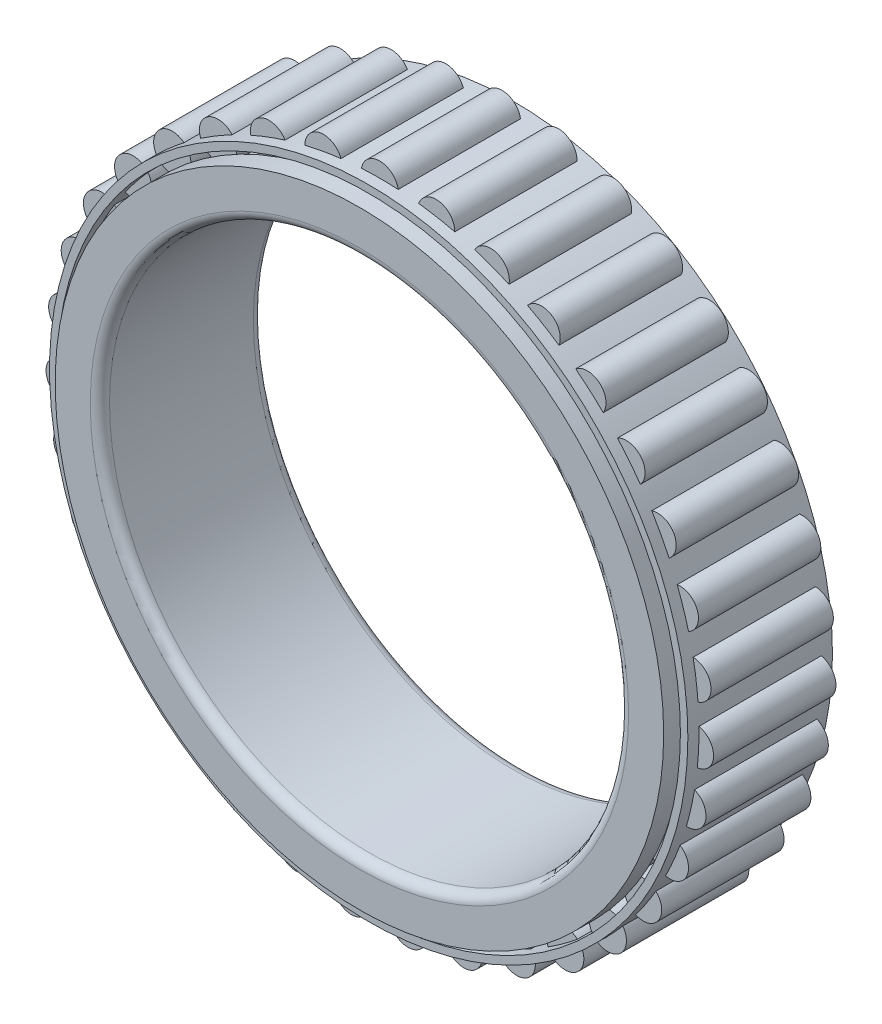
SolidWorks part; units mm, degrees
ref_plane "Front Plane" through (0, 0, 0) normal (0, 0, 1) x (1, 0, 0)
ref_plane "Top Plane" through (0, 0, 0) normal (0, 1, 0) x (1, 0, 0)
ref_plane "Right Plane" through (0, 0, 0) normal (1, 0, 0) x (0, 0, -1)
sketch "BaseSke" plane through (0, 0, 0) normal (1, 0, 0) x (0, 0, -1)
  line L0 (-42.3546, 0) -> (24.6132, 0) construction
  line L1 (-42.3546, 42.5375) -> (24.6132, 42.5375) construction
  line L2 (0, 129.5214) -> (0, -86.3012) construction
  line L3 (-8.25, 42.5375) -> (-8.25, 45.05) construction
  line L5 (-11, 35) -> (11, 35) construction
  line L6 (-8.25, 40.025) -> (8.25, 40.025)
  line L7 (-8.25, 40.025) -> (-8.25, 42.5375)
  line L8 (-8.25, 42.5375) -> (8.25, 42.5375)
  line L9 (8.25, 40.025) -> (8.25, 42.5375)
  line L10 (-8.25, 45.05) -> (8.25, 45.05) construction
  line L11 (8.25, 45.05) -> (8.25, 42.5375) construction
  line L12 (-8.25, 40.025) -> (-8.25, 35) construction
  line L13 (-8.25, 45.05) -> (-8.25, 40.025) construction
  dimension "D2" = 16.5
  dimension "Bearing_Thickness" = 22
  dimension "Bearing_Outside_Diameter" = 90.1
  dimension "Bearing_Inside_Diameter" = 70
revolve "Roller" add sketch "BaseSke" angle 360 about L8
sketch "OuterRaceSke" plane through (0, 0, 0) normal (1, 0, 0) x (0, 0, -1)
  line L0 (0, 0) -> (0, 87.5396) construction
  line L1 (-11, 35) -> (11, 35)
  line L2 (-11, 35) -> (-11, 41.03)
  line L3 (-11, 41.03) -> (-8.275, 41.03)
  line L4 (11, 35) -> (11, 41.03)
  line L5 (-50.3916, 0) -> (55.2197, 0) construction
  line L7 (8.275, 41.03) -> (11, 41.03)
  line L8 (-8.25, 40.025) -> (8.25, 40.025) construction
  line L9 (-8.275, 41.03) -> (-8.275, 40.045)
  line L10 (-8.275, 40.045) -> (8.275, 40.045)
  line L11 (8.275, 41.03) -> (8.275, 40.045)
  dimension "D1" = 16.55
  dimension "D2" = 82.06
  dimension "D3" = 0.02
revolve "OuterRace" add sketch "OuterRaceSke" angle 360 about L5
sketch "CageSke" plane through (0, 0, 0) normal (1, 0, 0) x (0, 0, -1)
  line L0 (-70.8626, 0) -> (113.5527, 0) construction
  line L1 (0, 58.441) -> (0, -70.8113) construction
  line L2 (-9.75, 42.035) -> (9.75, 42.035)
  line L3 (-9.75, 42.035) -> (-9.75, 43.04)
  line L4 (-33.2996, 42.5375) -> (13.017, 42.5375) construction
  line L5 (-42.3546, 42.5375) -> (24.6132, 42.5375) construction
  line L6 (0, 129.5214) -> (0, -86.3012) construction
  line L7 (-9.75, 43.04) -> (9.75, 43.04)
  line L9 (9.75, 42.035) -> (9.75, 43.04)
  point P17 (0, 42.035)
  dimension "D2" = 1.005
  dimension "D1" = 19.5
revolve "Cage" add sketch "CageSke" angle 360 about L0
fillet "Fillet1" radius 1.3 2 edges at (35, 0, -11) (35, 0, 11)
pattern_circular "CirPatternBall" count 35 over 360 about axis through (0, 0, 0) along (0, 0, 1) of "Roller"
sketch "SimplifiedSke" plane through (0, 0, 0) normal (1, 0, 0) x (0, 0, -1)
  line L0 (37.5911, 0) -> (-37.5911, 0) construction
  line L1 (-13.1351, 42.5375) -> (13.151, 42.5375) construction
  line L2 (-8.25, 45.05) -> (8.25, 45.05)
  line L3 (-8.25, 45.05) -> (-8.25, 40.025)
  line L4 (-8.25, 40.025) -> (8.25, 40.025)
  line L5 (8.25, 45.05) -> (8.25, 40.025)
  line L6 (-42.3546, 42.5375) -> (24.6132, 42.5375) construction
revolve "Simplified" [suppressed] add sketch "SimplifiedSke" angle 360 about L0
equation "\"D2@BaseSke\" = \"Bearing_Thickness@BaseSke\"*0.75"
equation "\"D1@OuterRaceSke\" = \"Bearing_Thickness@BaseSke\"*0.75+0.05"
equation "\"D1@CageSke\" = \"Bearing_Thickness@BaseSke\"*0.75+3"
equation "\"D2@OuterRaceSke\" = \"Bearing_Outside_Diameter@BaseSke\" -  ( \"Bearing_Outside_Diameter@BaseSke\" - \"Bearing_Inside_Diameter@BaseSke\" )  * 0.4"
equation "\"D2@CageSke\" =  ( \"Bearing_Outside_Diameter@BaseSke\" - \"Bearing_Inside_Diameter@BaseSke\" )  / 20"
equation "\"D1@CirPatternBall\" =  int( \"Bearing_Outside_Diameter@BaseSke\" *  pi  /  ( \"Bearing_Outside_Diameter@BaseSke\" - \"Bearing_Inside_Diameter@BaseSke\" )  * 2.5 ) "
